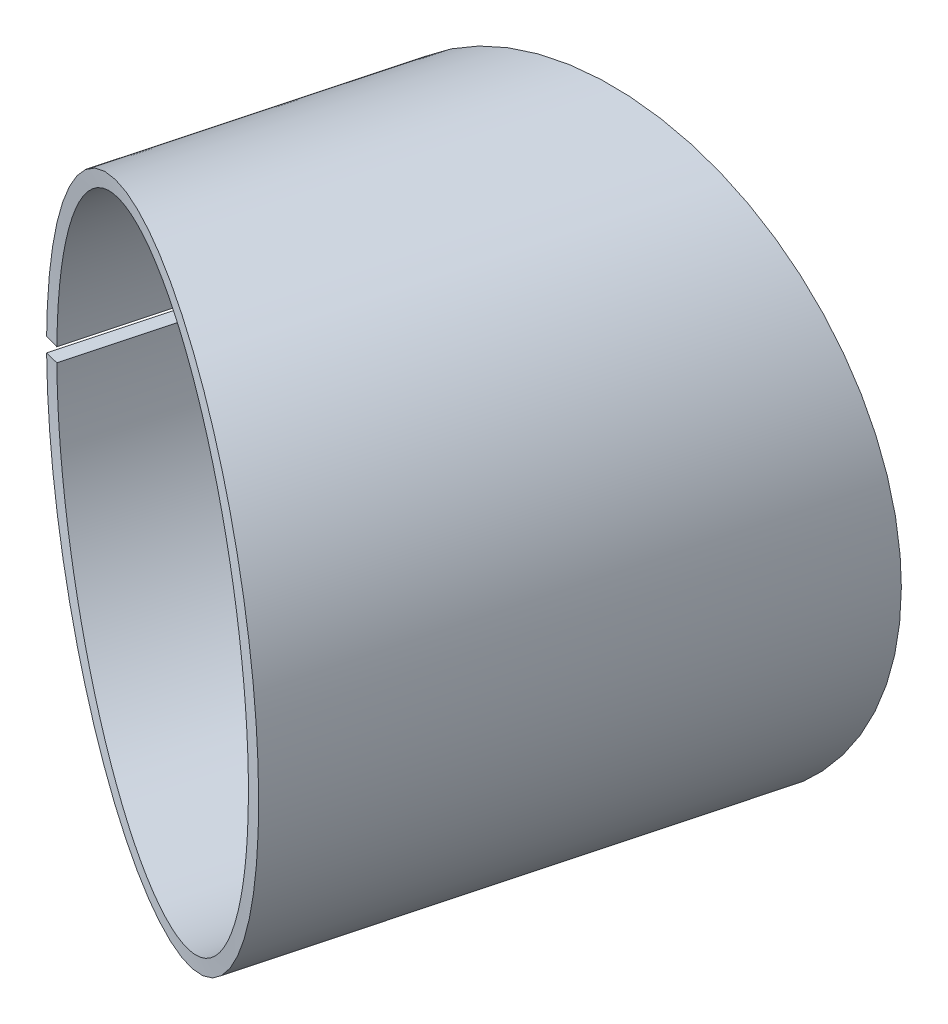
SolidWorks part; units mm, degrees
ref_plane "Płaszczyzna przednia" through (0, 0, 0) normal (0, 0, 1) x (1, 0, 0)
ref_plane "Płaszczyzna górna" through (0, 0, 0) normal (0, 1, 0) x (1, 0, 0)
ref_plane "Płaszczyzna prawa" through (0, 0, 0) normal (1, 0, 0) x (0, 0, -1)
sketch "Szkic1" plane through (0, 0, 0) normal (0, 0, 1) x (1, 0, 0)
  arc A0 (60.0125, -1) -> (60.0125, 1) centre (100, 0) ccw construction
  arc A1 (60.0125, -1) -> (60.0125, 1) centre (100, 0) ccw
sketch "Szkic2" plane through (0, 0, 0) normal (-0.5, 0, 0.866) x (0.866, 0, 0.5)
  arc A0 (60.0125, -1) -> (60.0125, 1) centre (100, 0) ccw construction
  arc A1 (60.0125, -1) -> (60.0125, 1) centre (100, 0) ccw
lofted bend "Zgięcia wyciągnięte po profilach1" thickness 2 parameters "D1"=0
other "Zgięcie swobodnego formowania1" parameters "D1"=1000, "D4"=57.296, "D5"=1
sketch "Linie zgięcia1" [suppressed] plane through (0, 0, 0) normal (0, 1, 0) x (1, 0, 0)
sketch "Ramka-graniczna1" [suppressed] plane through (0, 0, 0) normal (0, 1, 0) x (1, 0, 0)
sheet metal parameters "Arkusz blachy1" thickness 2 parameters "D1"=4
flat pattern "Rozłożony model1"
sketch "Linie zgięcia2" plane through (0, 0, 0) normal (0, 1, 0) x (1, 0, 0)
sketch3d "Ramka-graniczna2" [suppressed]
  line L0 (-34.6886, 239.0513, 0) -> (-36.2339, 0.2345, 0) construction
  line L1 (37.7792, 238.5824, 0) -> (36.2339, -0.2345, 0) construction
  line L2 (-34.6886, 239.0513, 0) -> (37.7792, 238.5824, 0) construction
  line L3 (-36.2339, 0.2345, 0) -> (36.2339, -0.2345, 0) construction
other "Rozłożone-<Zgięcie swobodnego formowania1>1"
